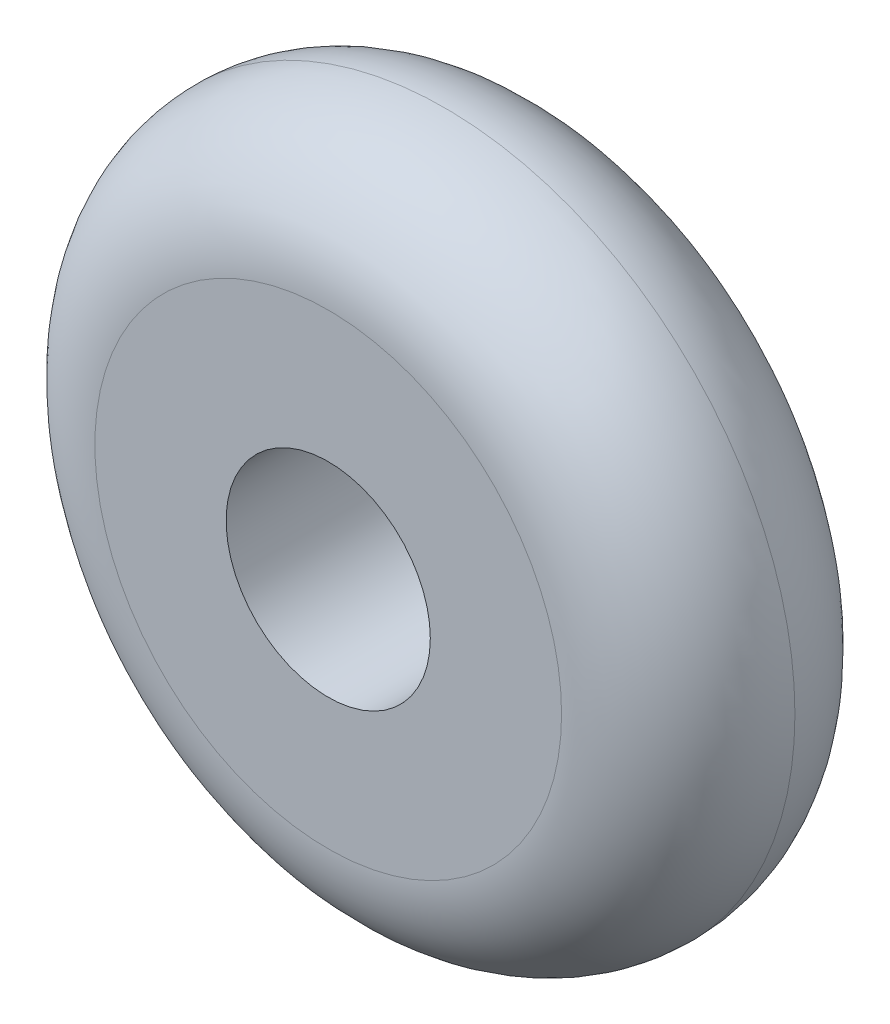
SolidWorks part; units mm, degrees
ref_plane "Front" through (0, 0, 0) normal (0, 0, 1) x (1, 0, 0)
ref_plane "Top" through (0, 0, 0) normal (0, 1, 0) x (1, 0, 0)
ref_plane "Right" through (0, 0, 0) normal (1, 0, 0) x (0, 0, -1)
sketch "Sketch1" plane through (0, 0, 0) normal (0, 0, 1) x (1, 0, 0)
  circle A0 centre (0, 0) radius 38.1
  circle A1 centre (0, 0) radius 11.1125
  dimension "D1" = 76.2
  dimension "D2" = 22.225
extrude "Extrude1" add sketch "Sketch1" along normal blind 25.4
fillet "Fillet1" radius 12.7 2 edges at (38.1, 0, 0) (38.1, 0, 25.4)
